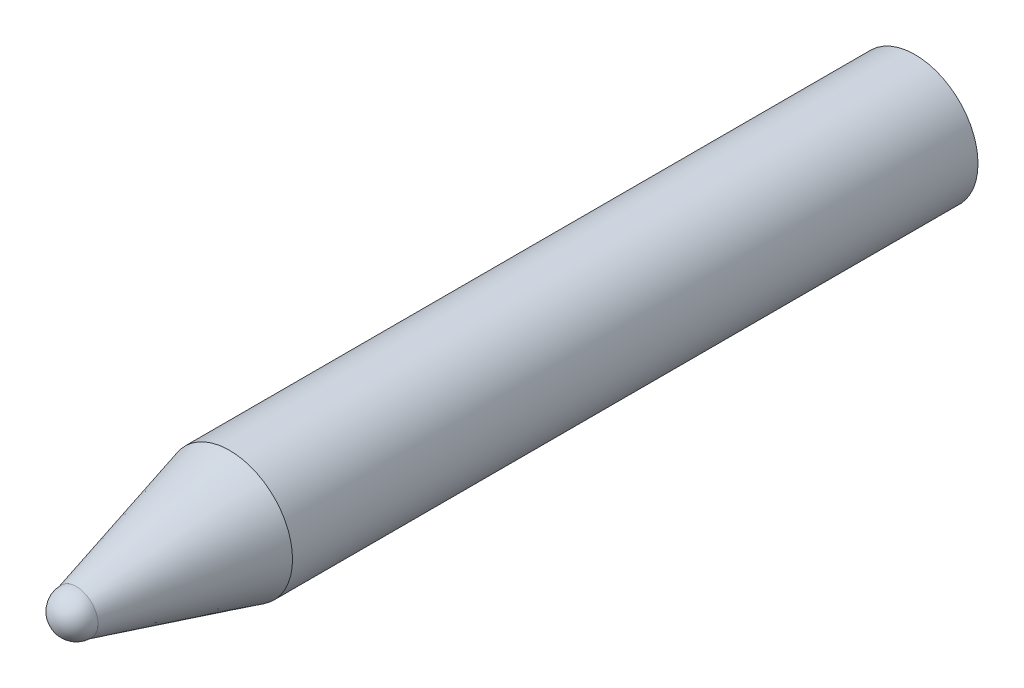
SolidWorks part; units mm, degrees
ref_plane "Front" through (0, 0, 0) normal (0, 0, 1) x (1, 0, 0)
ref_plane "Top" through (0, 0, 0) normal (0, 1, 0) x (1, 0, 0)
ref_plane "Right" through (0, 0, 0) normal (1, 0, 0) x (0, 0, -1)
sketch "Sketch1" plane through (0, 0, 0) normal (0, 0, 1) x (1, 0, 0)
  circle A0 centre (0, 0) radius 8.75
  dimension "D1" = 17.5
extrude "Extrude1" add sketch "Sketch1" along normal blind 116.6
chamfer "Chamfer1" distance 21.3 distance2 5.75
dome "Dome1" faces to dome 1 distance 3 parameters "D1"=3
shell "Shell1" thickness 1.33
